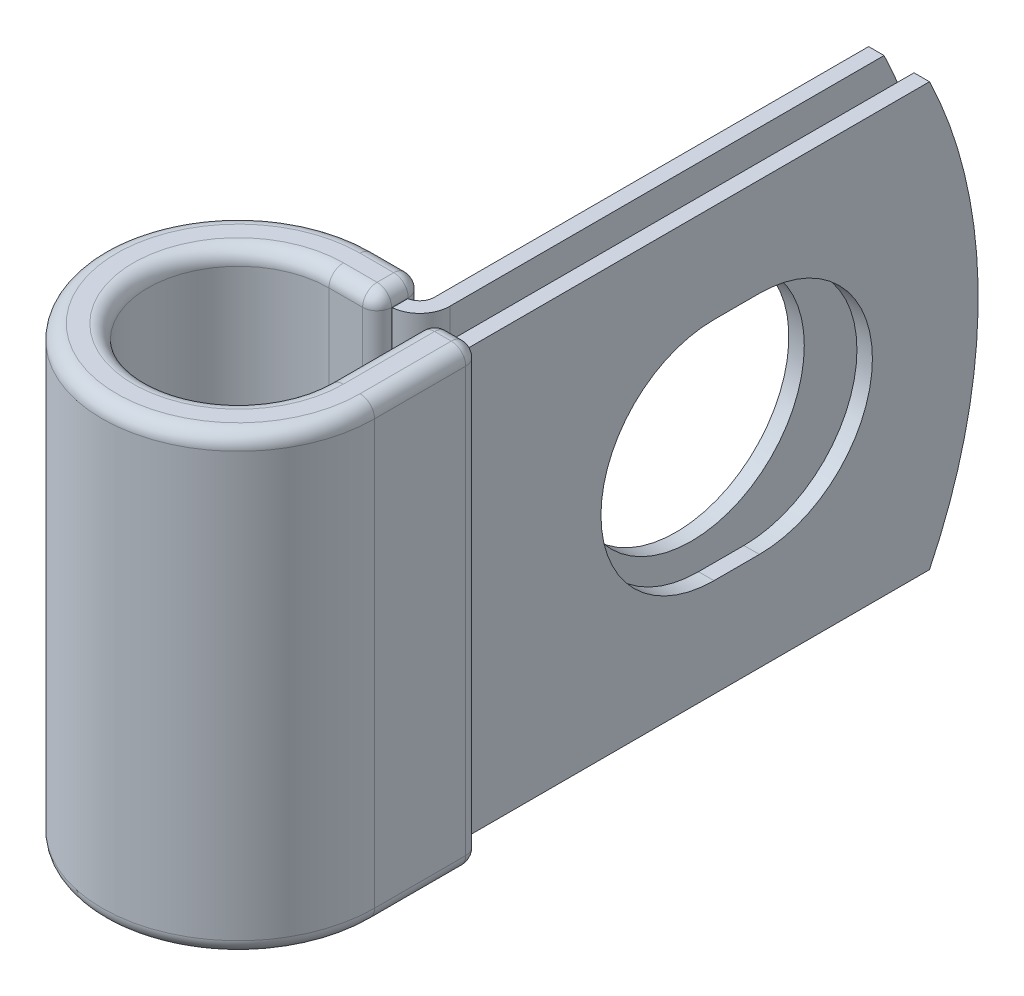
SolidWorks part; units mm, degrees
ref_plane "Front Plane" through (0, 0, 0) normal (0, 0, 1) x (1, 0, 0)
ref_plane "Top Plane" through (0, 0, 0) normal (0, 1, 0) x (1, 0, 0)
ref_plane "Right Plane" through (0, 0, 0) normal (1, 0, 0) x (0, 0, -1)
sketch "Sketch1" plane through (0, 0, 0) normal (0, 1, 0) x (1, 0, 0)
  line L0 (0, 5.5562) -> (2.3965, 5.5562)
  line L1 (5.5562, 0) -> (5.5562, 5.5562)
  line L2 (3.9814, 32.5374) -> (3.9815, 7.1412)
  line L5 (5.5562, 5.5562) -> (5.5562, 32.5374)
  arc A0 (0, 5.5562) -> (5.5562, 0) centre (0, 0) ccw
  arc A3 (2.3965, 5.5562) -> (3.9815, 7.1412) centre (2.3965, 7.1412) ccw
extrude "Extrude-Thin1" add sketch "Sketch1" along normal mid plane 22.225 thin
sketch "Sketch2" plane through (3.1687, 0, 0) normal (-1, 0, 0) x (0, 0, 1)
  line L0 (-32.5374, 11.1125) -> (-32.5374, -11.1125) construction
  line L7 (0, 11.1125) -> (0, -11.1125) construction
  circle A0 centre (-19.8374, 0) radius 5.9436
  point P2 (-32.5374, 0)
extrude "Cut-Extrude1" cut sketch "Sketch2" against normal up to surface (0.8128 mm away)
sketch "Sketch3" plane through (6.369, 0, 0) normal (1, 0, 0) x (0, 0, -1)
  line L0 (18.6436, 0) -> (21.0312, 0) construction
  line L1 (18.6436, 5.9436) -> (21.0312, 5.9436)
  line L2 (18.6436, -5.9436) -> (21.0312, -5.9436)
  line L3 (32.5374, 11.1125) -> (32.5374, -11.1125) construction
  arc A0 (18.6436, 5.9436) -> (18.6436, -5.9436) centre (18.6436, 0) ccw
  arc A1 (21.0312, -5.9436) -> (21.0312, 5.9436) centre (21.0312, 0) ccw
  point P3 (19.8374, 0)
  point P8 (32.5374, 0)
  point P11 (12.7, 0)
  point P12 (26.9748, 0)
extrude "Cut-Extrude2" cut sketch "Sketch3" against normal up to surface (0.8128 mm away)
sketch "Sketch4" plane through (3.1687, 0, 0) normal (-1, 0, 0) x (0, 0, 1)
  line L0 (-32.5374, 11.1125) -> (-32.5374, -11.1125)
  line L1 (-32.5374, 11.1125) -> (-29.9775, 11.1125)
  line L2 (-32.5374, 11.1125) -> (-7.1412, 11.1125) construction
  line L3 (-32.5374, -11.1125) -> (-29.9775, -11.1125)
  line L4 (-32.5374, -11.1125) -> (-7.1412, -11.1125) construction
  arc A0 (-29.9775, 11.1125) -> (-29.9775, -11.1125) centre (-7.1374, 0) ccw
extrude "Cut-Extrude3" cut sketch "Sketch4" against normal through all contours A0 M4 M5 | A0 L0 M2
ref_plane "Plane1" through (0, 0, -5.5562) normal (0, 0, 1) x (1, 0, 0)
ref_plane "Plane2" through (0, 0, 0) normal (-1, 0, 0) x (0, 0, 1)
sketch "Sketch5" plane through (0, 0, -5.5562) normal (0, 0, 1) x (1, 0, 0)
  line L0 (5.5562, 11.1125) -> (6.369, 11.1125)
  line L1 (5.5562, -11.1125) -> (5.5562, 11.1125)
  line L2 (4.7625, -11.1443) -> (4.7625, 11.1442)
  line L3 (6.369, 11.1125) -> (6.3691, -11.1125)
  line L4 (6.3691, -11.1125) -> (5.5562, -11.1125)
  line L5 (5.5245, 11.9062) -> (6.4008, 11.9062)
  line L7 (7.1628, 11.1442) -> (7.1628, -11.1443)
  line L8 (6.4008, -11.9062) -> (5.5245, -11.9062)
  line L9 (4.7625, -11.9062) -> (4.7625, 11.9062) construction
  line L11 (7.1628, -11.9062) -> (4.7625, -11.9062) construction
  line L12 (7.1628, 11.9062) -> (7.1628, -11.9062) construction
  line L13 (4.7625, 11.9062) -> (7.1628, 11.9062) construction
  arc A0 (4.7625, -11.1443) -> (5.5245, -11.9062) centre (5.5245, -11.1443) ccw
  arc A1 (7.1628, -11.1443) -> (6.4008, -11.9062) centre (6.4008, -11.1443) cw
  arc A2 (4.7625, 11.1442) -> (5.5245, 11.9062) centre (5.5245, 11.1442) cw
  arc A3 (6.4008, 11.9062) -> (7.1628, 11.1442) centre (6.4008, 11.1442) cw
sketch "Sketch6" plane through (0, 11.1125, 0) normal (0, 1, 0) x (1, 0, 0)
  line L0 (4.7625, 0) -> (4.7625, 5.5562)
  line L1 (0, 4.7625) -> (2.5337, 4.7625)
  line L2 (3.1686, 29.9775) -> (3.1687, 7.1412) construction
  arc A0 (0, 4.7625) -> (4.7625, 0) centre (0, 0) ccw
sweep "Sweep1" add profiles "Sketch5" path "Sketch6"
fillet "Fillet1" radius 0.762 16 edges at (2.5337, 11.6831, -6.9396) (2.5337, 0, -7.1628) (2.5337, -11.6831, -6.9396) (2.5337, -11.9062, -5.9627) (2.5337, -11.6831, -4.9857) (2.5337, 0, -4.7625) (2.5337, 11.6831, -4.9857) (6.9396, 11.6831, -5.5562) (7.1628, 0, -5.5562) (6.9396, -11.6831, -5.5562) (5.9627, -11.9062, -5.5562) (4.9857, -11.6831, -5.5562) (4.7625, 0, -5.5562) (4.9857, 11.6831, -5.5562) (2.5337, 11.9062, -5.9626) (5.9627, 11.9062, -5.5562)
equation "\"D4@Sketch5\" = \"D1@Extrude-Thin1\""
equation "\"D5@Sketch5\" = \"D5@Extrude-Thin1\""
equation "\"D1@Sketch3\" = \"D2@Sketch2\""
equation "\"D7@Sketch1\" = \"D3@Sketch2\" + \"D1@Sketch3\""
equation "\"D1@Sketch1\" = \"D1@Sketch6\" + 2 * \"D3@Sketch5\""
equation "\"D1@Sketch4\" = ( \"D1@Extrude-Thin1\" + .125 ) * 2"
equation "\"D2@Sketch1\"=1.95*\"D5@Extrude-Thin1\""
equation "\"D2@Sketch3\" = \"D1@Sketch2\""
